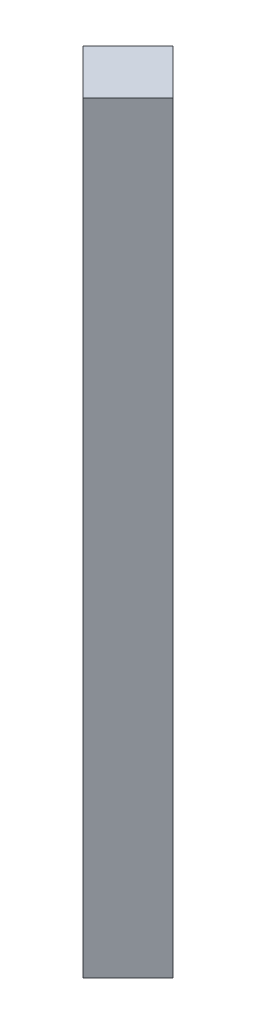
SolidWorks part; units mm, degrees
ref_plane "Front Plane" through (0, 0, 0) normal (0, 0, 1) x (1, 0, 0)
ref_plane "Top Plane" through (0, 0, 0) normal (0, 1, 0) x (1, 0, 0)
ref_plane "Right Plane" through (0, 0, 0) normal (1, 0, 0) x (0, 0, -1)
sketch "Sketch2" plane through (0, 0, 0) normal (0, 1, 0) x (1, 0, 0)
  line L1 (12.7, -5.2605) -> (30.6605, 12.7)
  line L2 (12.7, -5.2605) -> (-5.2605, 12.7)
  line L3 (-5.2605, 12.7) -> (12.7, 30.6605)
  line L4 (30.6605, 12.7) -> (12.7, 30.6605)
  dimension "D1" = 25.4
  dimension "D2" = 25.4
extrude "Boss-Extrude1" add sketch "Sketch2" along normal blind 304.8
